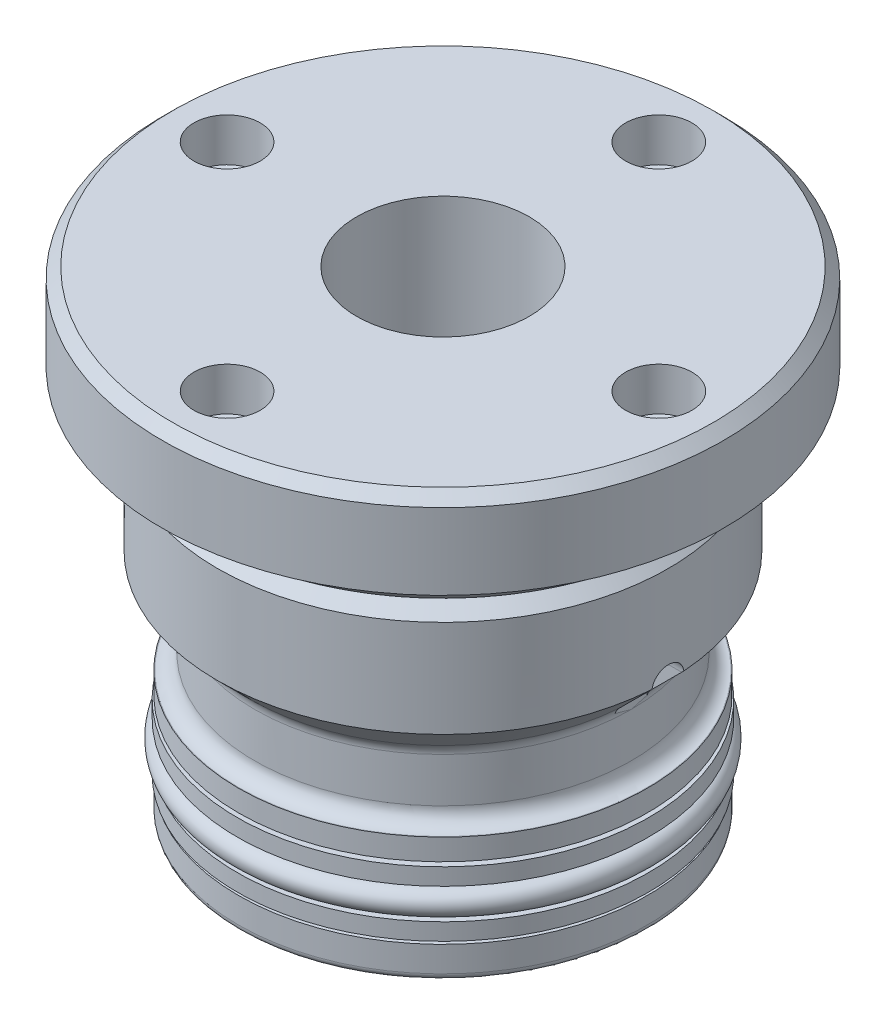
SolidWorks part; units mm, degrees
ref_plane "Front Plane" through (0, 0, 0) normal (0, 0, 1) x (1, 0, 0)
ref_plane "Top Plane" through (0, 0, 0) normal (0, 1, 0) x (1, 0, 0)
ref_plane "Right Plane" through (0, 0, 0) normal (1, 0, 0) x (0, 0, -1)
sketch "Sketch1" plane through (0, 0, 0) normal (0, 0, 1) x (1, 0, 0)
  line L0 (0, 0) -> (0, 29.1031) construction
  line L1 (-11.1125, 0) -> (-11.1125, 18.2372)
  line L2 (-11.1125, 18.2372) -> (-6.35, 18.2372)
  line L3 (-6.35, 18.2372) -> (-6.35, 34.925)
  line L4 (-6.35, 34.925) -> (-20.6375, 34.925)
  line L5 (-20.6375, 34.925) -> (-20.6375, 28.575)
  line L6 (-20.6375, 28.575) -> (-16.5862, 28.575)
  line L7 (-16.5862, 28.575) -> (-16.5862, 16.8529)
  line L8 (-16.5862, 16.8529) -> (-13.843, 14.1097)
  line L9 (-13.843, 14.1097) -> (-13.843, 9.2202)
  line L10 (-13.843, 9.2202) -> (-15.0368, 9.2202)
  line L11 (-15.0368, 9.2202) -> (-15.0368, 7.6454)
  line L12 (-15.0368, 7.6454) -> (-13.7795, 7.6454)
  line L13 (-13.7795, 7.6454) -> (-13.7795, 2.3876)
  line L14 (-13.7795, 2.3876) -> (-15.0368, 2.3876)
  line L15 (-15.0368, 2.3876) -> (-15.0368, 0)
  line L16 (-15.0368, 0) -> (-11.1125, 0)
  dimension "D1" = 18.2372
  dimension "D2" = 34.925
  dimension "D3" = 41.275
  dimension "D4" = 12.7
  dimension "D5" = 22.225
  dimension "D6" = 30.0736
  dimension "D7" = 2.3876
  dimension "D8" = 1.5748
  dimension "D9" = 27.559
  dimension "D10" = 5.2578
  dimension "D11" = 28.575
  dimension "D12" = 33.1724
  dimension "D13" = 27.686
  dimension "D14" = 16.8529
  dimension "D15" = 45
revolve "Revolve1" add sketch "Sketch1" angle 360 about L0
fillet "Fillet1" radius 1.143 2 edges at (0, 14.1097, -13.843) (0, 9.2202, -13.843)
fillet "Fillet2" radius 0.381 2 edges at (0, 7.6454, -13.7795) (0, 2.3876, -13.7795)
fillet "Fillet3" radius 0.508 1 edges at (0, 0, -15.0368)
hole_wizard "Hole1" positions "Sketch3" profile "Sketch2" legacy
sketch "Sketch3" plane through (0, 34.925, 0) normal (0, 1, 0) x (-1, 0, 0)
  circle A0 centre (0, 0) radius 15.875 construction
  point P0 (-15.875, 0)
  dimension "D1" = 15.875
sketch "Sketch2" plane through (15.875, 34.925, 0) normal (1, 0, 0) x (0, 0, 1)
  line L0 (0, 0) -> (0, 4.6401)
  line L1 (0, 4.6401) -> (2.4384, 3.175)
  line L2 (2.4384, 3.175) -> (2.4384, 0)
  line L4 (2.4384, 0) -> (0, 0)
  line L6 (0, 4.6401) -> (-2.4384, 3.175) construction
  line L7 (0, -4.2442) -> (0, 117.3081) construction
  dimension "Diameter" = 4.8768
  dimension "Depth" = 3.175
  dimension "Drill Angle" = 118
pattern_circular "CirPattern1" count 4 over 360 about axis through (0, 0, 0) along (0, 1, 0) of "Hole1"
chamfer "Chamfer1" distance 0.762 angle 45 1 edges at (0, 34.925, -20.6375)
sketch "Sketch4" plane through (0, 0, 0) normal (0, 0, 1) x (1, 0, 0)
  line L0 (0, 0) -> (0, 41.4124) construction
  line L1 (-16.5862, 28.575) -> (-16.5862, 23.9903)
  line L2 (-16.5862, 28.575) -> (-16.5862, 16.8529) construction
  line L3 (-16.5862, 23.9903) -> (-15.4559, 25.1206)
  line L4 (-15.4559, 25.1206) -> (-15.4559, 28.575)
  line L5 (-16.5862, 28.575) -> (16.5862, 28.575) construction
  line L6 (-15.4559, 28.575) -> (-16.5862, 28.575)
  line L8 (-14.5288, 0) -> (14.5288, 0) construction
  dimension "D1" = 30.9118
  dimension "D3" = 45
  dimension "D4" = 25.1206
revolve "Cut-Revolve1" cut sketch "Sketch4" angle 360 about L0
fillet "Fillet4" radius 0.381 2 edges at (0, 25.1206, -15.4559) (0, 28.575, -15.4559)
sketch "Sketch5" plane through (0, 0, 0) normal (0, 0, 1) x (1, 0, 0)
  line L0 (-20.6375, 28.575) -> (20.6375, 28.575) construction
  line L1 (0, 0) -> (0, 42.572) construction
  circle A0 centre (-16.7259, 27.2288) radius 1.3081
  dimension "D2" = 2.6162
  dimension "D1" = 1.3462
  dimension "D3" = 33.4518
revolve "Revolve2" add sketch "Sketch5" angle 360 about L1
sketch "Sketch6" plane through (0, 0, 0) normal (0, 0, 1) x (1, 0, 0)
  line L0 (0, 0) -> (0, 49.5791) construction
  line L1 (-13.7795, 7.2644) -> (-13.7795, 2.7686) construction
  line L2 (-13.7795, 6.1468) -> (-15.1257, 6.1468)
  line L3 (-13.7795, 6.1468) -> (-13.7795, 7.3914)
  line L4 (-13.7795, 7.3914) -> (-15.1257, 7.3914)
  line L5 (-15.1257, 6.1468) -> (-15.1257, 7.3914)
  line L6 (-13.7795, 5.0165) -> (-17.8863, 5.0165) construction
  line L7 (-15.1257, 3.8862) -> (-15.1257, 2.6416)
  line L8 (-13.7795, 2.6416) -> (-15.1257, 2.6416)
  line L9 (-13.7795, 3.8862) -> (-13.7795, 2.6416)
  line L10 (-13.7795, 3.8862) -> (-15.1257, 3.8862)
  line L11 (15.0368, 2.3876) -> (-15.0368, 2.3876) construction
  circle A0 centre (-14.6177, 4.9276) radius 0.889
  dimension "D4" = 1.778
  dimension "D5" = 29.2354
  dimension "D6" = 2.54
  dimension "D1" = 1.2446
  dimension "D2" = 30.2514
  dimension "D3" = 2.2606
revolve "Revolve3" add sketch "Sketch6" angle 360 about L0
sketch "Sketch7" plane through (0, 0, 0) normal (1, 0, 0) x (0, 0, -1)
  line L0 (-14.5288, 0) -> (14.5288, 0) construction
  circle A0 centre (0, 16.6878) radius 1.1811
  dimension "D1" = 2.3622
  dimension "D2" = 16.6878
extrude "Cut-Extrude1" cut sketch "Sketch7" against normal through all and the other way through all
sketch "Sketch8" plane through (0, 0, 0) normal (1, 0, 0) x (0, 0, -1)
  line L0 (-1.1811, 16.6878) -> (-1.1811, 11.9253)
  line L1 (0, 16.6878) -> (0, 11.9253) construction
  line L2 (1.1811, 16.6878) -> (1.1811, 11.9253)
  arc A0 (1.1811, 16.6878) -> (-1.1811, 16.6878) centre (0, 16.6878) ccw
  arc A1 (-1.1811, 11.9253) -> (1.1811, 11.9253) centre (0, 11.9253) ccw
  arc A2 (-1.1695, 16.8529) -> (1.1695, 16.8529) centre (0, 16.6878) ccw construction
  dimension "D1" = 4.7625
extrude "Cut-Extrude3" cut sketch "Sketch8" along normal blind 27.686 from offset 13.843
mirror "Mirror1" about plane through (0, 0, 0) normal (1, 0, 0) of "Cut-Extrude3"
